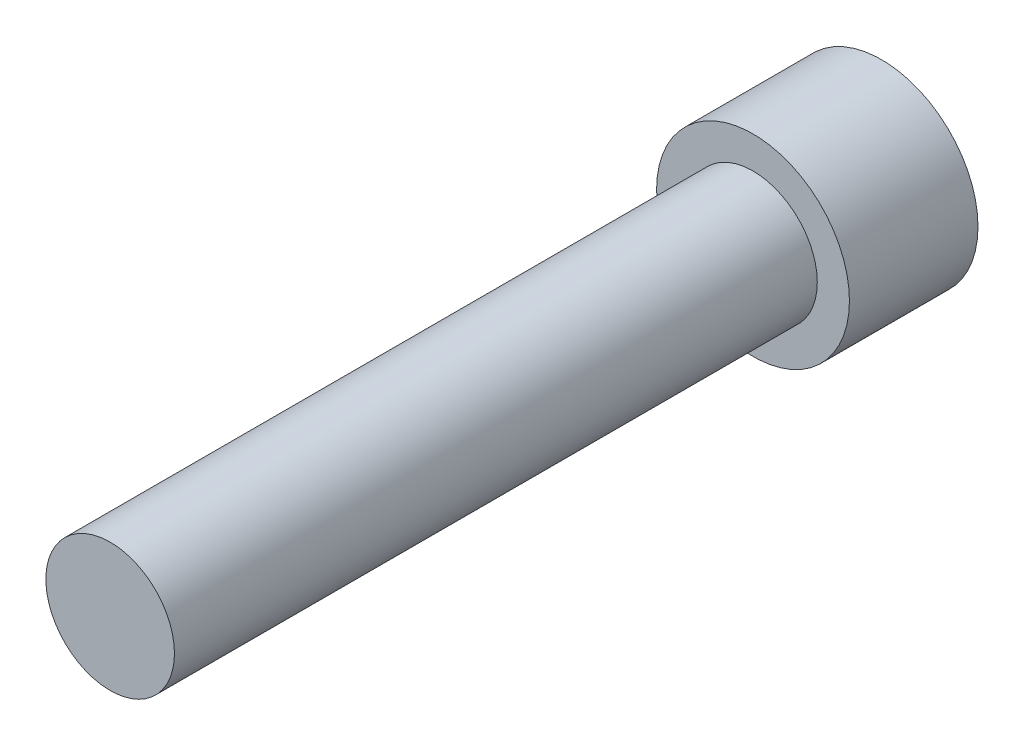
SolidWorks part; units mm, degrees
ref_plane "Front Plane" through (0, 0, 0) normal (0, 0, 1) x (1, 0, 0)
ref_plane "Top Plane" through (0, 0, 0) normal (0, 1, 0) x (1, 0, 0)
ref_plane "Right Plane" through (0, 0, 0) normal (1, 0, 0) x (0, 0, -1)
sketch "Sketch6" plane through (0, 0, 0) normal (1, 0, 0) x (0, 0, -1)
  line L0 (-31.75, 0) -> (22.525, 0) construction
  line L1 (5.2388, 0) -> (-5.2388, 0) construction
  line L2 (-31.75, 0) -> (-31.75, -3.175)
  line L3 (-31.75, -3.175) -> (0, -3.175)
  line L4 (0, 5.2388) -> (0, -5.2388) construction
  line L5 (0, -3.175) -> (0, -4.7625)
  line L6 (0, -4.7625) -> (6.35, -4.7625)
  line L7 (6.35, -4.7625) -> (6.35, 0)
  line L8 (6.35, 0) -> (-31.75, 0)
  dimension "L" = 31.75
  dimension "H" = 6.35
  dimension "A" = 9.525
  dimension "D" = 6.35
revolve "Revolve1" add sketch "Sketch6" angle 360 about L0
sketch "Sketch7" plane through (0, 0, -6.35) normal (0, 0, -1) x (-1, 0, 0)
  line L2 (-2.3876, 1.3785) -> (-2.3876, -1.3785)
  line L4 (-2.3876, -1.3785) -> (0, -2.757)
  line L5 (0, -2.757) -> (2.3876, -1.3785)
  line L6 (2.3876, -1.3785) -> (2.3876, 1.3785)
  line L7 (2.3876, 1.3785) -> (0, 2.757)
  line L8 (0, 2.757) -> (-2.3876, 1.3785)
  circle A0 centre (0, 0) radius 2.3876 construction
  dimension "J" = 4.7752
extrude "HEX" cut sketch "Sketch7" against normal blind 3.556
